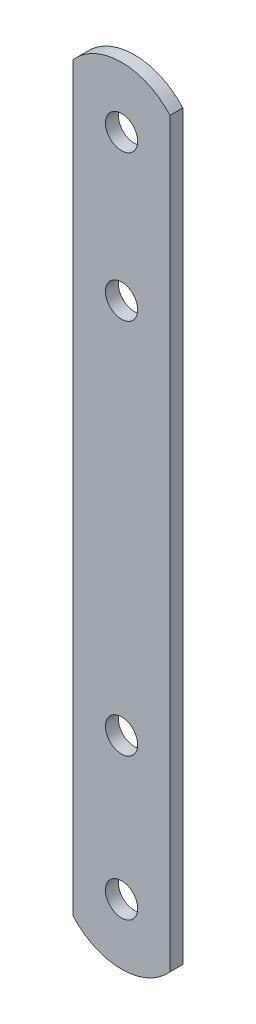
SolidWorks part; units mm, degrees
ref_plane "Face" through (0, 0, 0) normal (0, 0, 1) x (1, 0, 0)
ref_plane "Dessus" through (0, 0, 0) normal (0, 1, 0) x (1, 0, 0)
ref_plane "Droite" through (0, 0, 0) normal (1, 0, 0) x (0, 0, -1)
sketch "Esquisse1" plane through (0, 0, 0) normal (0, 0, 1) x (1, 0, 0)
  line L1 (7.5, 57.5) -> (-7.5, 57.5)
  line L2 (7.5, 57.5) -> (7.5, -57.5)
  line L3 (7.5, -57.5) -> (-7.5, -57.5)
  line L4 (-7.5, 57.5) -> (-7.5, -57.5)
  arc A0 (7.5, 57.5) -> (-7.5, 57.5) centre (0, 50.8856) ccw
  arc A1 (7.5, -57.5) -> (-7.5, -57.5) centre (0, -50.8856) cw
  circle A2 centre (0, 51.5) radius 2.5
  circle A3 centre (0, 28.8856) radius 2.5
  circle A4 centre (0, -29.5) radius 2.5
  circle A5 centre (0, -51.5) radius 2.5
  dimension "D5" = 10
  dimension "D6" = 10
  dimension "D7" = 5
  dimension "D8" = 6
  dimension "D10" = 5
  dimension "D13" = 5
  dimension "D14" = 5
  dimension "D1" = 115
  dimension "D2" = 57.5
  dimension "D3" = 15
  dimension "D4" = 7.5
  dimension "D9" = 7.5
  dimension "D11" = 22
  dimension "D12" = 7.5
  dimension "D15" = 22
  dimension "D16" = 6
  dimension "D17" = 7.5
  dimension "D18" = 7.5
extrude "Extrusion1" add sketch "Esquisse1" against normal blind 2 contours A1 L3 | L1 L4 L3 L2 A5 A4 A3 A2 | L1 A0
